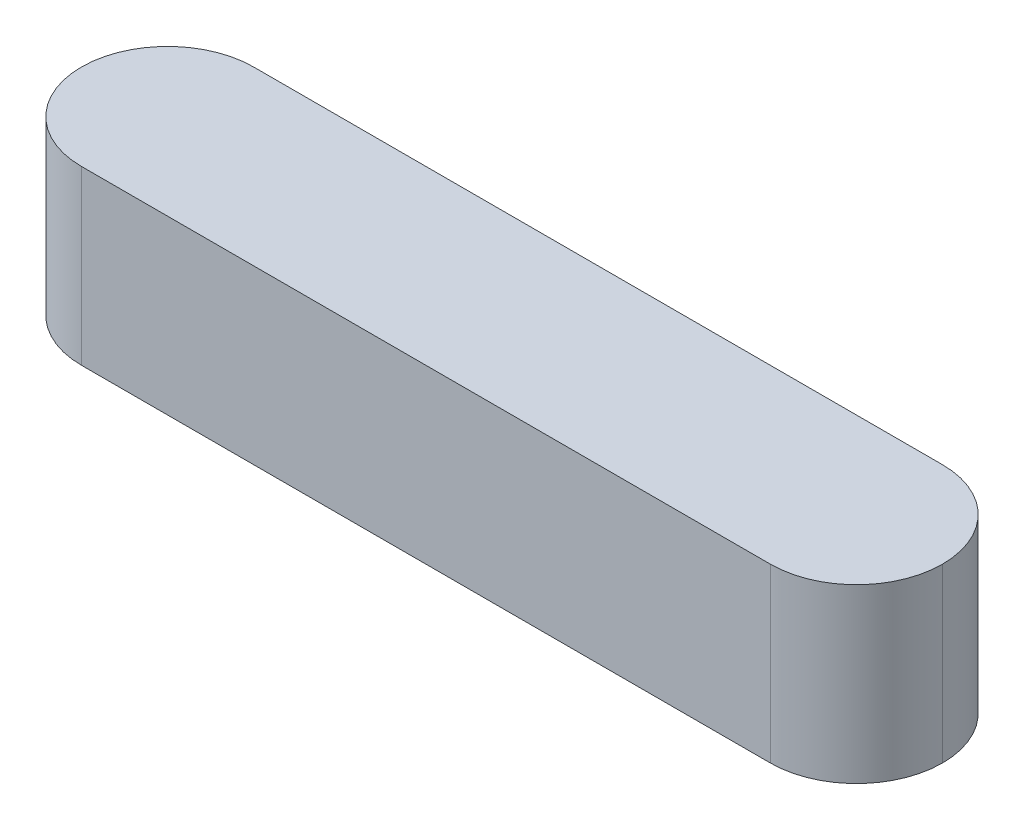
SolidWorks part; units mm, degrees
ref_plane "前视基准面" through (0, 0, 0) normal (0, 0, 1) x (1, 0, 0)
ref_plane "上视基准面" through (0, 0, 0) normal (0, 1, 0) x (1, 0, 0)
ref_plane "右视基准面" through (0, 0, 0) normal (1, 0, 0) x (0, 0, -1)
sketch "草图1" plane through (0, 0, 0) normal (0, 1, 0) x (1, 0, 0)
  line L1 (-7.5, -1.5) -> (7.5, -1.5)
  line L2 (-7.5, -1.5) -> (-7.5, 1.5)
  line L3 (-7.5, 1.5) -> (7.5, 1.5)
  line L4 (7.5, -1.5) -> (7.5, 1.5)
  line L5 (-7.5, -1.5) -> (7.5, 1.5) construction
  line L6 (-7.5, 1.5) -> (7.5, -1.5) construction
  point P0 (0, 0)
  dimension "D1" = 3
  dimension "D2" = 15
extrude "凸台-拉伸1" add sketch "草图1" along normal blind 3
fillet "圆角1" radius 1.5 4 edges at (-7.5, 1.5, 1.5) (-7.5, 1.5, -1.5) (7.5, 1.5, -1.5) (7.5, 1.5, 1.5)
